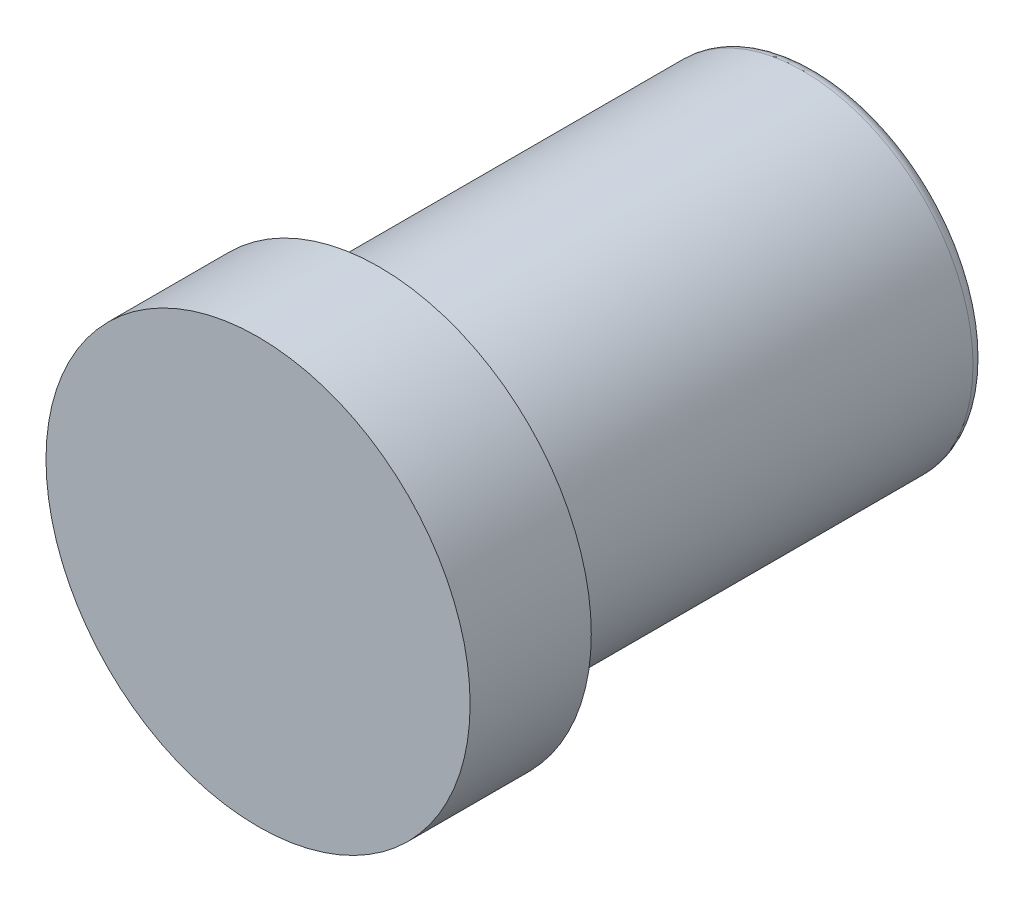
SolidWorks part; units mm, degrees
ref_plane "Front Plane" through (0, 0, 0) normal (0, 0, 1) x (1, 0, 0)
ref_plane "Top Plane" through (0, 0, 0) normal (0, 1, 0) x (1, 0, 0)
ref_plane "Right Plane" through (0, 0, 0) normal (1, 0, 0) x (0, 0, -1)
sketch "Sketch1" plane through (0, 0, 0) normal (1, 0, 0) x (0, 0, -1)
  line L0 (0, 0) -> (46, 0) construction
  line L1 (46, 0) -> (46, 13)
  line L2 (45, 14) -> (10, 14)
  line L3 (10, 14) -> (10, 17.5)
  line L4 (10, 17.5) -> (0, 17.5)
  line L5 (0, 17.5) -> (0, 0)
  line L6 (0, 0) -> (46, 0)
  arc A0 (46, 13) -> (45, 14) centre (45, 13) ccw
  dimension "D5" = 1
  dimension "D1" = 28
  dimension "D2" = 35
  dimension "D3" = 10
  dimension "D4" = 36
revolve "Revolve1" add sketch "Sketch1" angle 360 about L0
hole_wizard "M6 Tapped Hole1" positions "Sketch5" profile "Sketch4" tap size "M6" standard "AS"
sketch "Sketch5" plane through (0, 0, -46) normal (0, 0, -1) x (-1, 0, 0)
  point P0 (0, 0)
sketch "Sketch4" plane through (0, 0, -46) normal (1, 0, 0) x (0, 1, 0)
  line L0 (0, 0) -> (0, 9.5022)
  line L1 (0, 9.5022) -> (2.5, 8)
  line L2 (2.5, 8) -> (2.5, 0.525)
  line L3 (2.5, 0.525) -> (3.025, 0)
  line L5 (3.025, 0) -> (0, 0)
  line L6 (-2.5, 0.525) -> (-3.025, 0) construction
  line L10 (0, 9.5022) -> (-2.5, 8) construction
  line L11 (0, -6.35) -> (0, 107.95) construction
  dimension "Tap Drill Dia." = 5
  dimension "Tap Drill Depth" = 8
  dimension "Near C'Sink Dia." = 6.05
  dimension "Near C'Sink Angle" = 90
  dimension "Drill Angle" = 118
